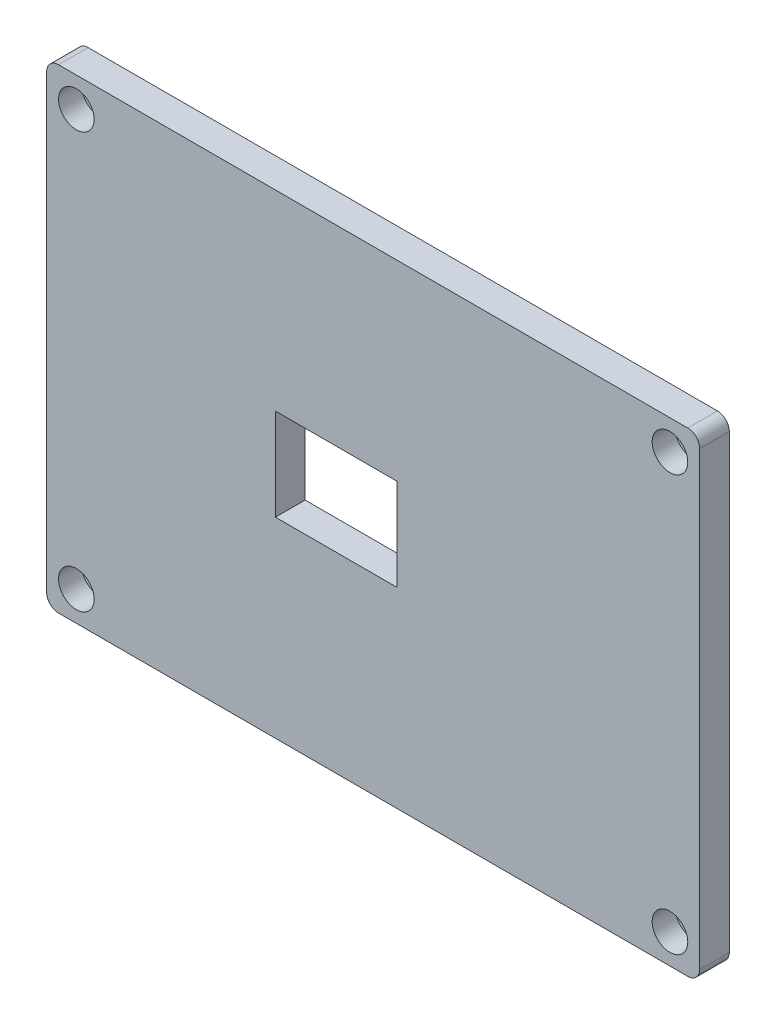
SolidWorks part; units mm, degrees
ref_plane "Front Plane" through (0, 0, 0) normal (0, 0, 1) x (1, 0, 0)
ref_plane "Top Plane" through (0, 0, 0) normal (0, 1, 0) x (1, 0, 0)
ref_plane "Right Plane" through (0, 0, 0) normal (1, 0, 0) x (0, 0, -1)
sketch "Sketch2" plane through (0, 0, 0) normal (0, 0, 1) x (1, 0, 0)
  line L0 (69.85, -48.26) -> (69.85, 48.26) construction
  line L1 (-69.85, -50.8) -> (69.85, -50.8)
  line L2 (-69.85, -50.8) -> (-69.85, 50.8)
  line L3 (-69.85, 50.8) -> (69.85, 50.8)
  line L4 (69.85, -50.8) -> (69.85, 50.8)
  line L5 (-69.85, -50.8) -> (69.85, 50.8) construction
  line L6 (-69.85, 50.8) -> (69.85, -50.8) construction
  line L7 (67.31, 50.8) -> (-67.31, 50.8) construction
  circle A0 centre (-63.5, 44.45) radius 2.4765
  circle A1 centre (63.5, 44.45) radius 2.4765
  circle A2 centre (63.5, -44.45) radius 2.4765
  circle A3 centre (-63.5, -44.45) radius 2.4765
  circle A4 centre (63.5, 44.45) radius 2.4765 construction
  point P0 (0, 0)
extrude "Boss-Extrude1" add sketch "Sketch2" along normal blind 6.35
sketch "Sketch3" plane through (0, 0, 6.35) normal (0, 0, 1) x (1, 0, 0)
  circle A0 centre (-63.5, -44.45) radius 3.81
  circle A1 centre (-63.5, 44.45) radius 3.81
  circle A2 centre (63.5, 44.45) radius 3.81
  circle A3 centre (63.5, -44.45) radius 3.81
  dimension "D1" = 7.62
extrude "Cut-Extrude1" cut sketch "Sketch3" against normal blind 4.953
fillet "Fillet1" radius 2.54 4 edges at (69.85, 50.8, 3.175) (-69.85, 50.8, 3.175) (-69.85, -50.8, 3.175) (69.85, -50.8, 3.175)
sketch "Sketch5" plane through (0, 0, 6.35) normal (0, 0, 1) x (1, 0, 0)
  line L0 (-20.611, 9.525) -> (4.7982, 9.525) construction
  line L1 (-20.611, 9.525) -> (4.7982, 9.525) construction
  line L2 (-20.611, 9.525) -> (-20.611, -9.525) construction
  line L3 (-20.611, -9.525) -> (4.7982, -9.525) construction
  line L4 (4.7982, 9.525) -> (4.7982, -9.525) construction
  line L5 (-20.611, 9.525) -> (4.7982, -9.525) construction
  line L6 (-20.611, -9.525) -> (4.7982, 9.525) construction
  line L7 (4.7982, -9.525) -> (4.7982, 9.525) construction
  line L8 (-20.611, -9.525) -> (-20.611, 9.525) construction
  line L9 (-20.611, -9.525) -> (4.7982, -9.525) construction
  line L10 (-20.9158, 9.8298) -> (5.103, 9.8298)
  line L11 (5.103, 9.8298) -> (5.103, -9.8298)
  line L12 (-20.9158, -9.8298) -> (5.103, -9.8298)
  line L13 (-20.9158, 9.8298) -> (-20.9158, -9.8298)
  point P0 (-7.9064, 0)
  dimension "D1" = 0.3048
extrude "Cut-Extrude2" cut sketch "Sketch5" against normal through all both and the other way through all
